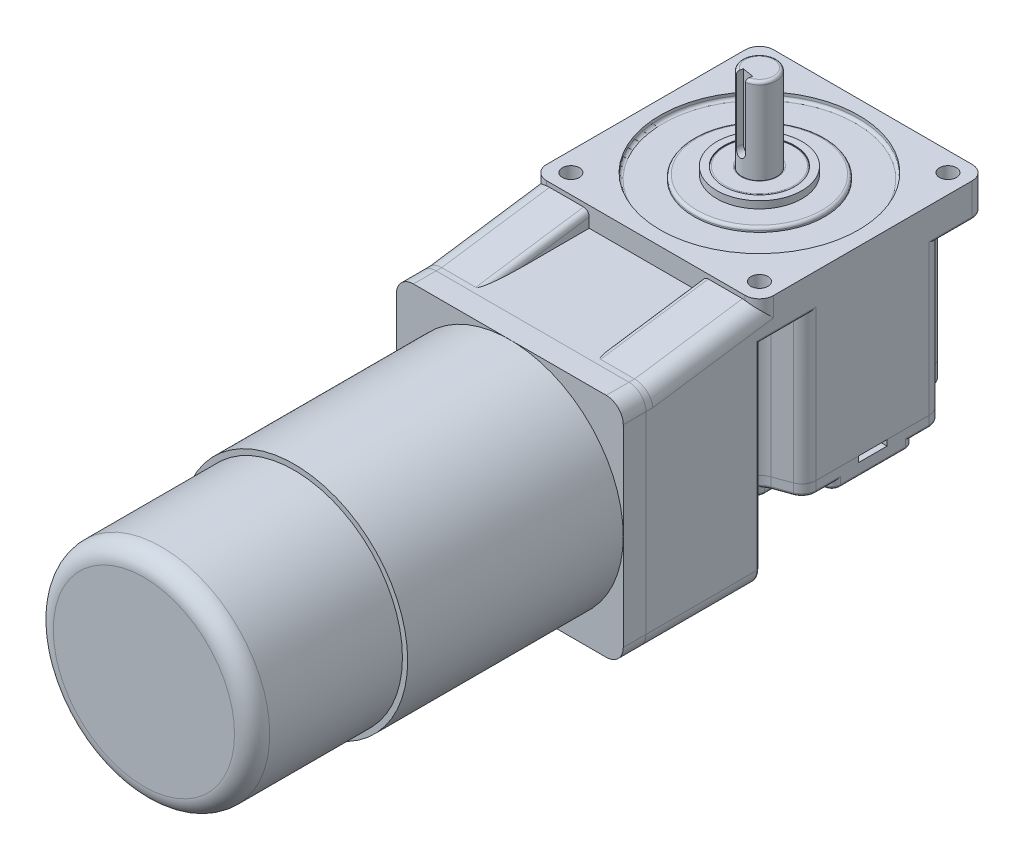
SolidWorks part; units mm, degrees
ref_plane "前视基准面" through (0, 0, 0) normal (0, 0, 1) x (1, 0, 0)
ref_plane "上视基准面" through (0, 0, 0) normal (0, 1, 0) x (1, 0, 0)
ref_plane "右视基准面" through (0, 0, 0) normal (1, 0, 0) x (0, 0, -1)
imported_body "80改进实心箱体-1-surface1"
imported_body "输出轴-1-surface1"
imported_body "油封-1-surface1"
imported_body "80改进实心出轴盖-1-surface1"
sketch "草图1" plane through (0, 0, 60) normal (0, 0, 1) x (1, 0, 0)
  line L1 (11.8565, 30.6056) -> (23.8565, 30.6056) construction
  line L3 (-44.1435, -49.3944) -> (23.8565, -49.3944)
  line L4 (-50.1435, -43.3944) -> (-50.1435, 24.6056)
  line L5 (-44.1435, 30.6056) -> (23.8565, 30.6056)
  line L6 (29.8565, -43.3944) -> (29.8565, 24.6056)
  line L7 (-50.1435, -49.3944) -> (29.8565, 30.6056) construction
  line L8 (-50.1435, 30.6056) -> (29.8565, -49.3944) construction
  arc A4 (23.8565, -49.3944) -> (29.8565, -43.3944) centre (23.8565, -43.3944) ccw
  arc A5 (-44.1435, -49.3944) -> (-50.1435, -43.3944) centre (-44.1435, -43.3944) cw
  arc A6 (-50.1435, 24.6056) -> (-44.1435, 30.6056) centre (-44.1435, 24.6056) cw
  arc A7 (23.8565, 30.6056) -> (29.8565, 24.6056) centre (23.8565, 24.6056) cw
  point P12 (-10.1435, -9.3944)
  dimension "D1" = 6
extrude "凸台-拉伸1" add sketch "草图1" along normal blind 8
sketch "草图2" plane through (0, 0, 68) normal (0, 0, 1) x (1, 0, 0)
  circle A0 centre (-10.1435, -9.3944) radius 40
extrude "凸台-拉伸2" add sketch "草图2" along normal blind 76 separate body
sketch "草图3" plane through (0, 0, 144) normal (0, 0, 1) x (1, 0, 0)
  circle A0 centre (-10.1435, -9.3944) radius 38.15
extrude "凸台-拉伸3" add sketch "草图3" along normal blind 53 separate body
fillet "圆角1" radius 6.2 1 edges at (28.0065, -9.3944, 197)
